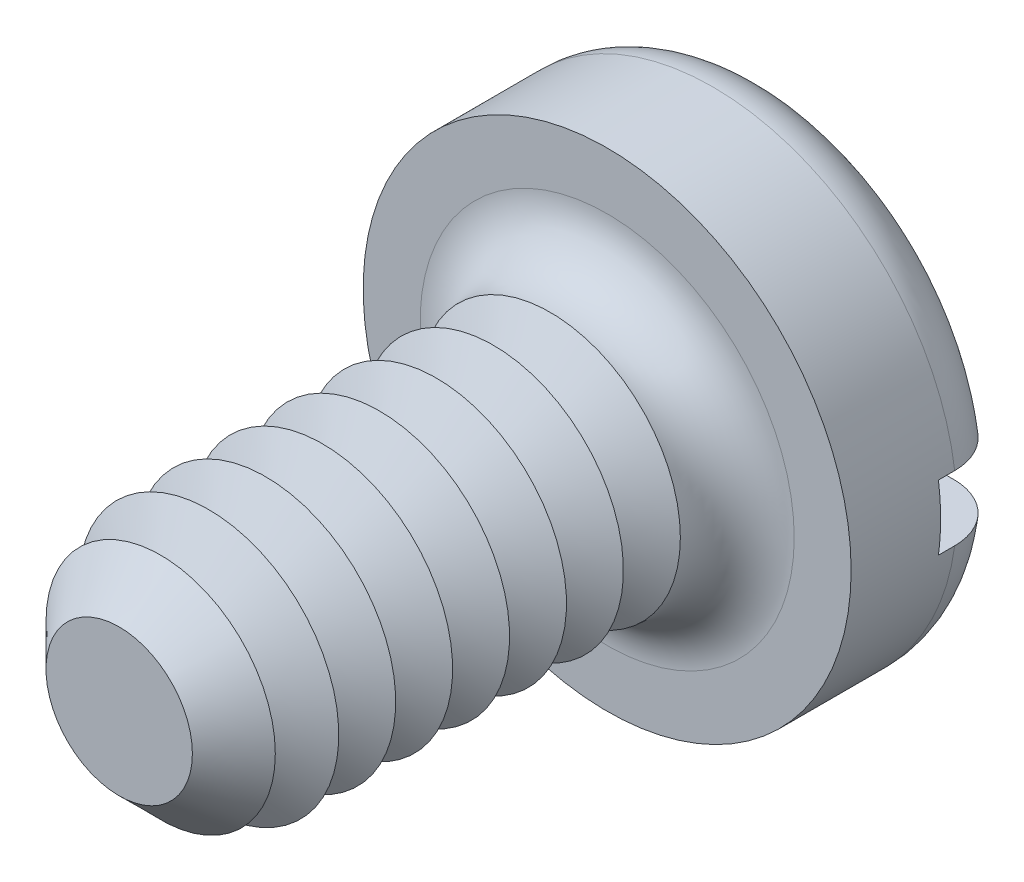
SolidWorks part; units mm, degrees
ref_plane "Front Plane" through (0, 0, 0) normal (0, 0, 1) x (1, 0, 0)
ref_plane "Top Plane" through (0, 0, 0) normal (0, 1, 0) x (1, 0, 0)
ref_plane "Right Plane" through (0, 0, 0) normal (1, 0, 0) x (0, 0, -1)
sketch "Sketch3" plane through (0, 0, 0) normal (0, 0, 1) x (1, 0, 0)
  circle A0 centre (0, 0) radius 1.5
  dimension "D1" = 3
extrude "Boss-Extrude2" add sketch "Sketch3" against normal blind 1
sketch "Sketch4" plane through (0, 0, 0) normal (0, 0, 1) x (1, 0, 0)
  circle A0 centre (0, 0) radius 0.8
  dimension "D1" = 1.6
extrude "Boss-Extrude3" add sketch "Sketch4" along normal blind 3
fillet "Fillet1" radius 0.35 2 edges at (1.5, 0, -1) (0.8, 0, 0)
chamfer "Chamfer1" distance 0.35 angle 45 1 edges at (0.8, 0, 3)
sketch "Sketch5" plane through (0, 0, 0) normal (1, 0, 0) x (0, 0, -1)
  line L0 (1.6944, 0) -> (-7.6738, 0) construction
sketch "Sketch6" plane through (0, 0, 0) normal (1, 0, 0) x (0, 0, -1)
  line L0 (-0.35, 0.8) -> (-0.525, 0.4969)
  line L1 (-0.525, 0.4969) -> (-0.7, 0.8)
  line L2 (-0.35, 0.8) -> (-2.65, 0.8) construction
  line L3 (-0.7, 0.8) -> (-0.35, 0.8)
  dimension "D1" = 0.35
revolve "Cut-Revolve1" cut sketch "Sketch6" angle 360 about L0
pattern_linear "LPattern1" count 7 spacing 0.35 along (0, 0, 1) of "Cut-Revolve1"
sketch "Sketch8" plane through (0, 0, -1) normal (0, 0, -1) x (-1, 0, 0)
  line L1 (1.5, -0.2) -> (-1.5, -0.2)
  line L2 (1.5, -0.2) -> (1.5, 0.2)
  line L3 (1.5, 0.2) -> (-1.5, 0.2)
  line L4 (-1.5, -0.2) -> (-1.5, 0.2)
  line L5 (1.5, -0.2) -> (-1.5, 0.2) construction
  line L6 (1.5, 0.2) -> (-1.5, -0.2) construction
  point P0 (0, 0)
  dimension "D1" = 3
  dimension "D2" = 0.4
extrude "Cut-Extrude1" cut sketch "Sketch8" against normal blind 0.45
